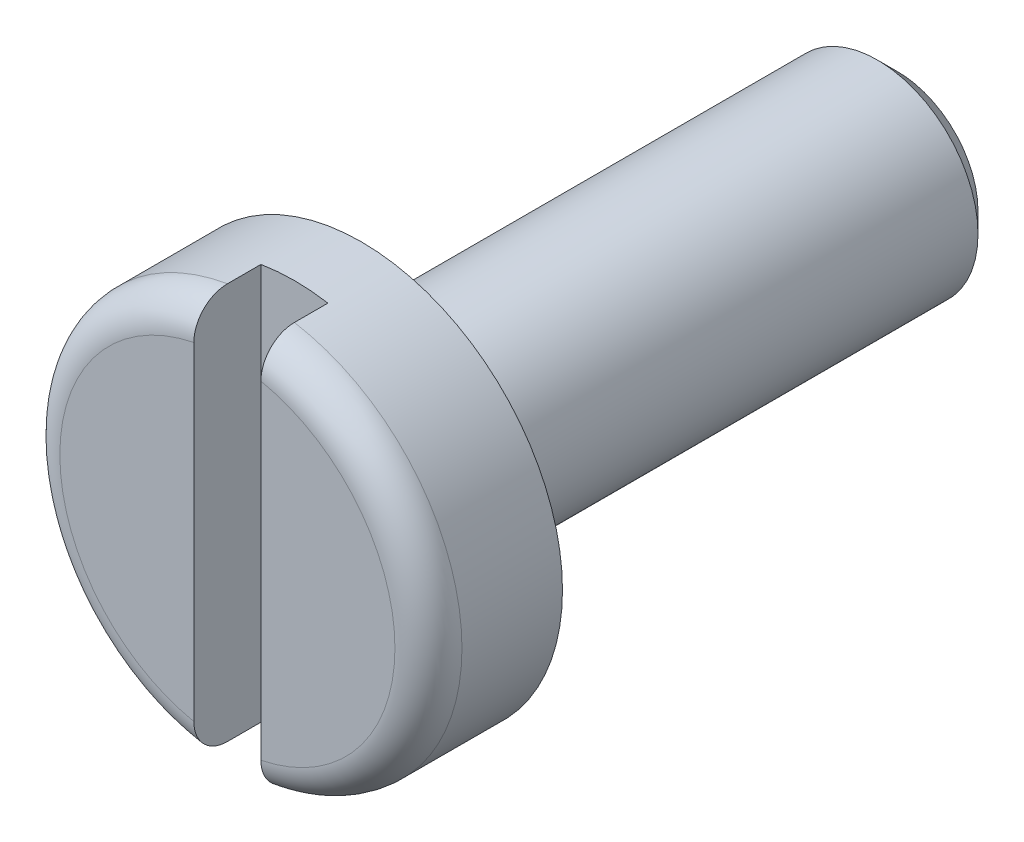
SolidWorks part; units mm, degrees
ref_plane "Plan de face" through (0, 0, 0) normal (0, 0, 1) x (1, 0, 0)
ref_plane "Plan de dessus" through (0, 0, 0) normal (0, 1, 0) x (1, 0, 0)
ref_plane "Plan de droite" through (0, 0, 0) normal (1, 0, 0) x (0, 0, -1)
sketch "Esquisse1" plane through (0, 0, 0) normal (0, 0, 1) x (1, 0, 0)
  circle A0 centre (0, 0) radius 1.5
extrude "Extrusion1" add sketch "Esquisse1" along normal blind 8
sketch "Esquisse2" plane through (0, 0, 8) normal (0, 0, 1) x (1, 0, 0)
  circle A0 centre (0, 0) radius 3
extrude "Extrusion2" add sketch "Esquisse2" along normal blind 2
fillet "Congé1" radius 0.5 1 edges at (3, 0, 10)
chamfer "Chanfrein1" distance 0.3 angle 45 1 edges at (1.5, 0, 0)
sketch "Esquisse3" plane through (0, 0, 10) normal (0, 0, 1) x (1, 0, 0)
  line L0 (-0.5, 3.2286) -> (0.5, 3.2286)
  line L1 (-0.5, 3.2286) -> (-0.5, -3.3817)
  line L2 (0.5, 3.2286) -> (0.5, -3.3817)
  line L3 (-0.5, -3.3817) -> (0.5, -3.3817)
extrude "Enlèv. mat.-Extru.1" cut sketch "Esquisse3" against normal blind 1
